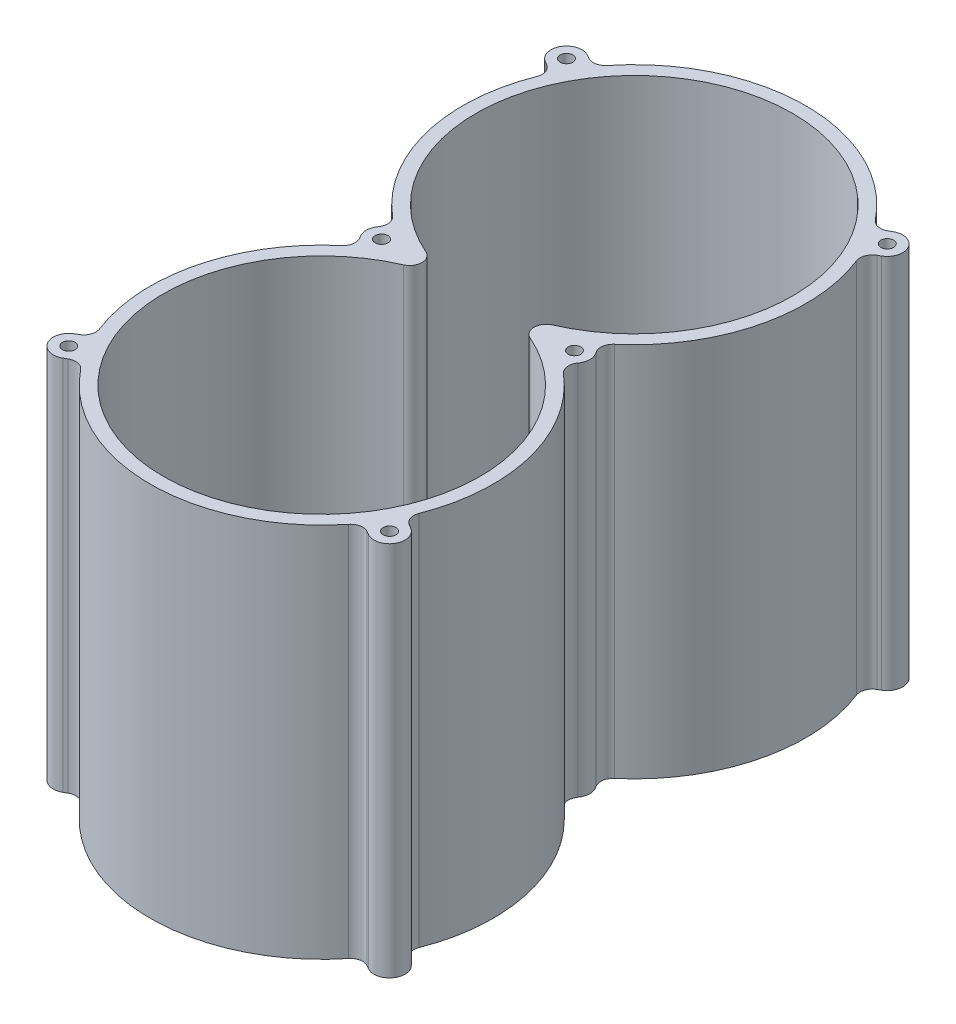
SolidWorks part; units mm, degrees
ref_plane "Front" through (0, 0, 0) normal (0, 0, 1) x (1, 0, 0)
ref_plane "Top" through (0, 0, 0) normal (0, 1, 0) x (1, 0, 0)
ref_plane "Right" through (0, 0, 0) normal (1, 0, 0) x (0, 0, -1)
sketch "Sketch1" plane through (0, 0, 0) normal (0, 1, 0) x (1, 0, 0)
  line L0 (0, 40.5) -> (0, -40.5) construction
  arc A3 (18.3181, 0) -> (-18.3181, 0) centre (0, 40.5) ccw
  arc A4 (-18.3181, 0) -> (18.3181, 0) centre (0, -40.5) ccw
  arc A5 (6.5171, 0) -> (-6.5171, 0) centre (0, 40.5) ccw
  arc A6 (-6.5171, 0) -> (6.5171, 0) centre (0, -40.5) ccw
  point P6 (0, 0)
  dimension "D1" = 81
  dimension "D2" = 88.9
  dimension "D3" = 3.429
extrude "Boss-Extrude1" add sketch "Sketch1" along normal mid plane 97.46
fillet "Fillet1" radius 3.175 2 edges at (-18.3181, 0, 0) (18.3181, 0, 0)
fillet "Fillet2" radius 3.175 2 edges at (-6.5171, 0, 0) (6.5171, 0, 0)
sketch "Sketch3" plane through (0, -48.73, 0) normal (0, 1, 0) x (1, 0, 0)
  line L0 (0, -40.5) -> (-41.5692, -64.5) construction
  line L1 (-43.5692, -61.0359) -> (-40.3386, -59.1707)
  line L2 (-39.5692, -67.9641) -> (-36.3386, -66.0989)
  line L3 (0, -40.5) -> (0, -81.521) construction
  arc A0 (-23.3872, -2.7) -> (23.3872, -2.7) centre (0, -40.5) ccw construction
  arc A1 (-43.5692, -61.0359) -> (-39.5692, -67.9641) centre (-41.5692, -64.5) ccw
  arc A5 (-40.3386, -59.1707) -> (-36.3386, -66.0989) centre (0, -40.5) ccw
  arc A6 (-16.4218, -2.9095) -> (16.4218, -2.9095) centre (0, -40.5) ccw construction
  dimension "D2" = 8
  dimension "D1" = 48
  dimension "D3" = 60
extrude "Boss-Extrude2" add sketch "Sketch3" along normal up to surface (97.46 mm away)
pattern_circular "CirPattern1" count 2 over 120 about axis through (0, 0, 40.5) along (0, 1, 0) of "Boss-Extrude2"
mirror "Mirror7" about plane through (0, 0, 0) normal (0, 0, 1) of "CirPattern1", "Boss-Extrude2"
fillet "Fillet4" radius 3.175 8 edges at (40.3386, 0, -59.1707) (36.3386, 0, -66.0989) (-36.3386, 0, -66.0989) (-40.3386, 0, -59.1707) (-40.3386, 0, 59.1707) (40.3386, 0, 59.1707) (36.3386, 0, 66.0989) (-36.3386, 0, 66.0989)
sketch "Sketch6" plane through (0, -48.73, 0) normal (0, -1, 0) x (1, 0, 0)
  line L0 (-25, 0) -> (25, 0) construction
  circle A0 centre (-25, 0) radius 4
  circle A1 centre (25, 0) radius 4
  point P6 (0, 0)
  dimension "D1" = 8
  dimension "D2" = 50
extrude "Boss-Extrude3" add sketch "Sketch6" against normal up to surface (97.46 mm away)
fillet "Fillet5" radius 3.175 4 edges at (-25.3467, 0, -3.9849) (-25.3467, 0, 3.9849) (25.3467, 0, 3.9849) (25.3467, 0, -3.9849)
hole_wizard "M4x0.7 Tapped Hole1" positions "Sketch9" profile "Sketch8" tap size "M4x0.7" standard "ANSI Metric"
sketch "Sketch9" plane through (0, -48.73, 0) normal (0, -1, 0) x (-1, 0, 0)
  point P0 (-25, 0)
  point P3 (-41.5692, 64.5)
  point P6 (41.5692, 64.5)
  point P9 (25, 0)
  point P12 (41.5692, -64.5)
  point P15 (-41.5692, -64.5)
sketch "Sketch8" plane through (25, -48.73, 0) normal (1, 0, 0) x (0, 0, -1)
  line L0 (0, 0) -> (0, 97.46)
  line L1 (0, 97.46) -> (1.65, 97.46)
  line L2 (1.65, 97.46) -> (1.65, 0)
  line L5 (1.65, 0) -> (0, 0)
  line L11 (0, -6.35) -> (0, 107.95) construction
  dimension "Thru Tap Drill Dia." = 3.3
  dimension "Thru Tap Drill Depth" = 97.46
